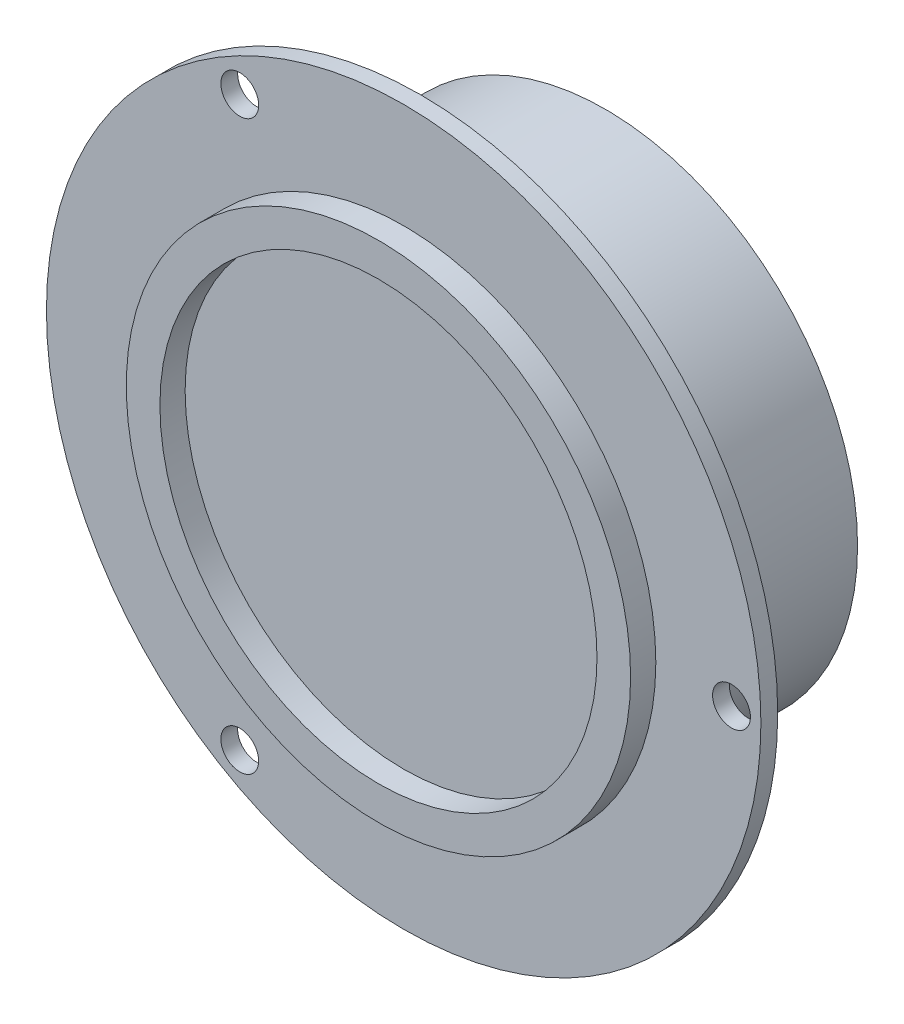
SolidWorks part; units mm, degrees
ref_plane "前视基准面" through (0, 0, 0) normal (0, 0, 1) x (1, 0, 0)
ref_plane "上视基准面" through (0, 0, 0) normal (0, 1, 0) x (1, 0, 0)
ref_plane "右视基准面" through (0, 0, 0) normal (1, 0, 0) x (0, 0, -1)
sketch "草图1" plane through (0, 0, 0) normal (0, 0, 1) x (1, 0, 0)
  circle A0 centre (0, 0) radius 30
extrude "凸台-拉伸1" add sketch "草图1" along normal blind 22
sketch "草图2" plane through (0, 0, 22) normal (0, 0, 1) x (1, 0, 0)
  line L0 (0, 0) -> (39, 0) construction
  circle A0 centre (0, 0) radius 42.5
  circle A1 centre (39, 0) radius 2.25
  circle A2 centre (-19.5, -33.775) radius 2.25
  circle A3 centre (-19.5, 33.775) radius 2.25
  point P11 (0, 0)
  dimension "D1" = 3
extrude "凸台-拉伸2" add sketch "草图2" along normal blind 2
sketch "草图3" plane through (0, 0, 24) normal (0, 0, 1) x (1, 0, 0)
  circle A0 centre (0, 0) radius 30
  circle A1 centre (0, 0) radius 26
extrude "凸台-拉伸3" add sketch "草图3" along normal blind 3
sketch "草图4" plane through (0, 0, 0) normal (0, 0, -1) x (-1, 0, 0)
  line L1 (-0.6526, 6.8974) -> (-6.2996, 2.8835)
  line L2 (-6.2996, 2.8835) -> (-5.647, -4.0139)
  line L3 (-5.647, -4.0139) -> (0.6526, -6.8974)
  line L4 (0.6526, -6.8974) -> (6.2996, -2.8835)
  line L5 (6.2996, -2.8835) -> (5.647, 4.0139)
  line L6 (5.647, 4.0139) -> (-0.6526, 6.8974)
  circle A0 centre (0, 0) radius 6 construction
extrude "凸台-拉伸4" add sketch "草图4" along normal blind 10
